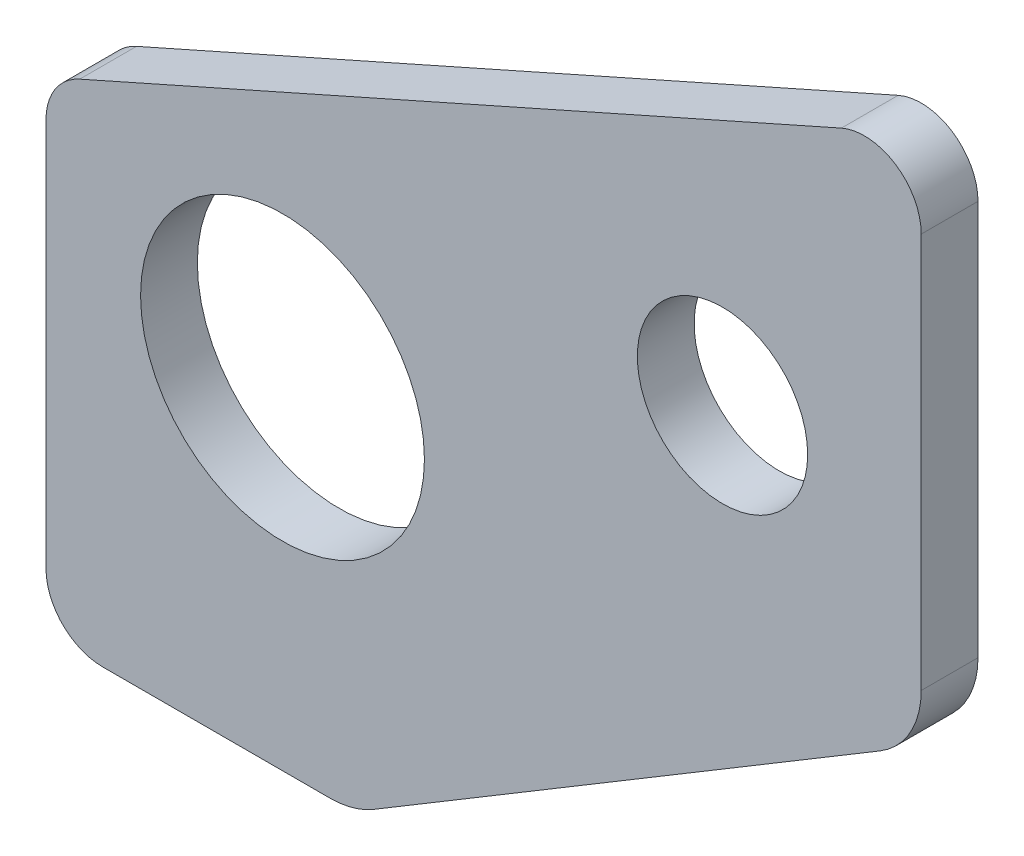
SolidWorks part; units mm, degrees
ref_plane "Face" through (0, 0, 0) normal (0, 0, 1) x (1, 0, 0)
ref_plane "Dessus" through (0, 0, 0) normal (0, 1, 0) x (1, 0, 0)
ref_plane "Droite" through (0, 0, 0) normal (1, 0, 0) x (0, 0, -1)
sketch "Esquisse1" plane through (0, 0, 0) normal (0, 0, 1) x (1, 0, 0)
  line L0 (-2.9027, 31.6765) -> (14.9282, 42.3751)
  line L1 (16.3848, 58.8704) -> (16.3848, 44.9476)
  line L2 (13.5727, 60.6981) -> (-13.2583, 48.7768)
  line L3 (-14.4462, 46.9491) -> (-14.4462, 33.249)
  line L4 (-12.4462, 31.249) -> (-4.4462, 31.249)
  line L5 (-4.4462, 31.249) -> (-12.4462, 31.249) construction
  arc A0 (-2.9027, 31.6765) -> (-4.4462, 31.249) centre (-4.4462, 34.249) cw
  arc A1 (-14.4462, 33.249) -> (-12.4462, 31.249) centre (-12.4462, 33.249) ccw
  arc A2 (-13.2583, 48.7768) -> (-14.4462, 46.9491) centre (-12.4462, 46.9491) ccw
  arc A3 (13.5727, 60.6981) -> (16.3848, 58.8704) centre (14.3848, 58.8704) cw
  arc A4 (16.3848, 44.9476) -> (14.9282, 42.3751) centre (13.3848, 44.9476) cw
  circle A5 centre (-6.1152, 43.249) radius 5
  circle A7 centre (9.3848, 50.1437) radius 3
  dimension "D1" = 12
  dimension "D4" = 6
  dimension "D3" = 10
  dimension "D2" = 22.5
  dimension "D5" = 8.7267
  dimension "D6" = 7.9448
  dimension "D7" = 7.952
extrude "Extrusion1" add sketch "Esquisse1" against normal blind 2
